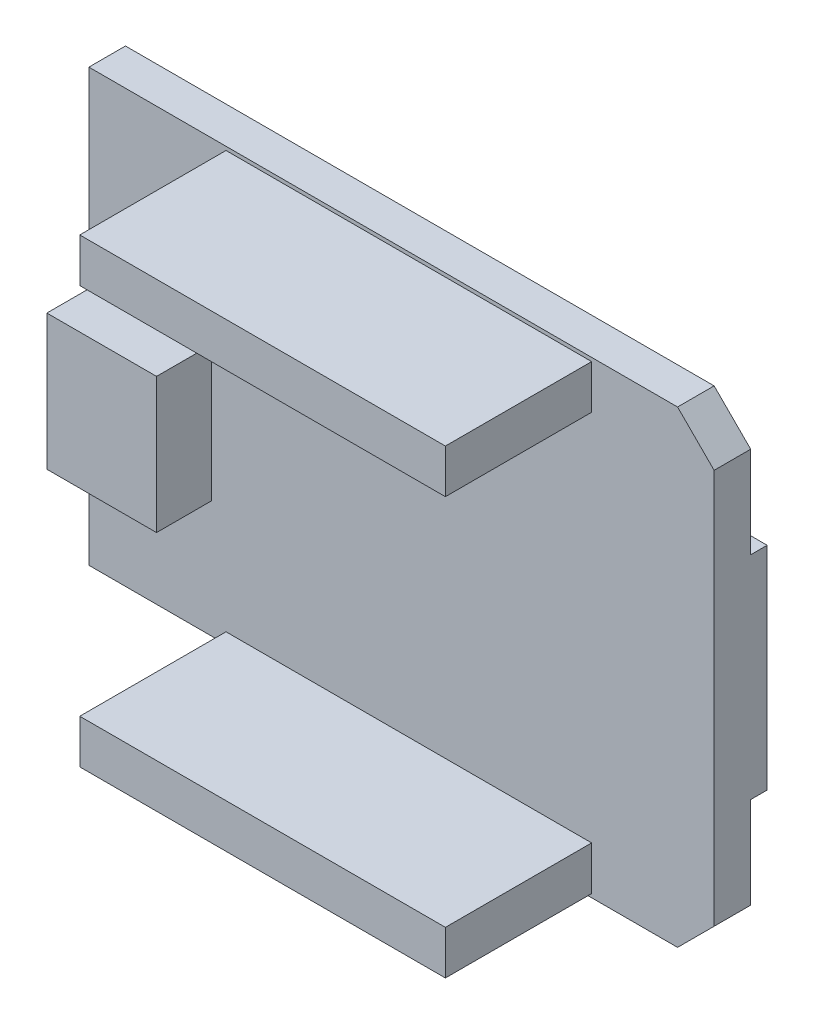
SolidWorks part; units mm, degrees
ref_plane "Plan de face" through (0, 0, 0) normal (0, 0, 1) x (1, 0, 0)
ref_plane "Plan de dessus" through (0, 0, 0) normal (0, 1, 0) x (1, 0, 0)
ref_plane "Plan de droite" through (0, 0, 0) normal (1, 0, 0) x (0, 0, -1)
sketch "Esquisse1" plane through (0, 0, 0) normal (0, 0, 1) x (1, 0, 0)
  line L0 (17.1819, 10.1033) -> (19.1819, 8.1033)
  line L1 (-15.0181, 10.1033) -> (17.1819, 10.1033)
  line L2 (-15.0181, 10.1033) -> (-15.0181, 1.1033)
  line L3 (-7.6181, -15.4967) -> (17.1819, -15.4967)
  line L4 (19.1819, 8.1033) -> (19.1819, -13.4967)
  line L5 (19.1819, -13.4967) -> (17.1819, -15.4967)
  line L6 (-15.0181, -7.8967) -> (-15.0181, -13.4967)
  line L7 (-15.0181, -13.4967) -> (-7.6181, -13.4967)
  line L10 (-7.6181, -13.4967) -> (-7.6181, -15.4967)
  line L11 (-15.0181, 1.1033) -> (-14.0181, 1.1033)
  line L13 (-15.0181, -7.8967) -> (-14.0181, -7.8967)
  line L14 (-14.0181, 1.1033) -> (-14.0181, -7.8967)
  dimension "D1" = 2
  dimension "D2" = 2
  dimension "D3" = 2
  dimension "D4" = 2
  dimension "D5" = 34.2
  dimension "D6" = 25.6
  dimension "D7" = 7.4
  dimension "D8" = 2
  dimension "D9" = 9
  dimension "D10" = 9
  dimension "D11" = 1
extrude "Boss.-Extru.1" add sketch "Esquisse1" along normal blind 2
sketch "Esquisse2" plane through (0, 0, 2) normal (0, 0, 1) x (1, 0, 0)
  line L2 (-7.5181, 9.9033) -> (-7.5181, 7.5033)
  line L3 (-7.5181, 7.5033) -> (12.4819, 7.5033)
  line L4 (12.4819, 9.9033) -> (12.4819, 7.5033)
  line L5 (-15.0181, 10.1033) -> (-15.0181, 1.1033) construction
  line L6 (-7.5181, -15.2967) -> (12.4819, -15.2967)
  line L7 (-7.5181, -15.2967) -> (-7.5181, -12.8967)
  line L8 (-7.5181, -12.8967) -> (12.4819, -12.8967)
  line L9 (12.4819, -15.2967) -> (12.4819, -12.8967)
  line L12 (-7.5181, 9.9033) -> (12.4819, 9.9033)
  line L13 (17.1819, 10.1033) -> (-15.0181, 10.1033) construction
  line L14 (-7.6181, -15.4967) -> (17.1819, -15.4967) construction
  line L15 (-15.0181, -7.8967) -> (-15.0181, -13.4967) construction
  dimension "D1" = 20
  dimension "D2" = 20
  dimension "D3" = 0.2
  dimension "D4" = 2.4
  dimension "D5" = 7.5
  dimension "D6" = 0.2
  dimension "D7" = 2.4
  dimension "D8" = 7.5
extrude "Boss.-Extru.2" add sketch "Esquisse2" along normal blind 8
sketch "Esquisse4" plane through (0, 0, 2) normal (0, 0, 1) x (1, 0, 0)
  line L1 (-14.3181, 0.3033) -> (-8.3181, 0.3033)
  line L2 (-14.3181, 0.3033) -> (-14.3181, -7.0967)
  line L3 (-14.3181, -7.0967) -> (-8.3181, -7.0967)
  line L4 (-8.3181, 0.3033) -> (-8.3181, -7.0967)
  line L5 (-15.0181, 1.1033) -> (-14.0181, 1.1033) construction
  line L6 (-14.0181, -7.8967) -> (-15.0181, -7.8967) construction
  line L7 (-15.0181, 10.1033) -> (-15.0181, 1.1033) construction
  dimension "D1" = 0.8
  dimension "D2" = 0.8
  dimension "D3" = 6
  dimension "D4" = 0.7
extrude "Boss.-Extru.3" add sketch "Esquisse4" along normal blind 3
sketch "Esquisse5" plane through (0, 0, 0) normal (0, 0, -1) x (-1, 0, 0)
  line L0 (7.6181, -15.4967) -> (-17.1819, -15.4967) construction
  line L1 (2.8181, -8.4967) -> (-12.1819, -8.4967)
  line L2 (2.8181, -8.4967) -> (2.8181, 3.1033)
  line L3 (2.8181, 3.1033) -> (-12.1819, 3.1033)
  line L4 (-12.1819, -8.4967) -> (-12.1819, 3.1033)
  line L5 (-17.1819, 10.1033) -> (15.0181, 10.1033) construction
  line L6 (-19.1819, -13.4967) -> (-19.1819, 8.1033) construction
  dimension "D1" = 7
  dimension "6" = 7
  dimension "D2" = 7
  dimension "D3" = 15
extrude "Boss.-Extru.4" add sketch "Esquisse5" along normal blind 3
sketch "Esquisse6" plane through (0, 0, 0) normal (0, 0, -1) x (-1, 0, 0)
  line L0 (-12.1819, 3.1033) -> (-12.1819, -8.4967) construction
  line L1 (-12.1819, 3.1033) -> (-19.1819, 3.1033)
  line L2 (-12.1819, 3.1033) -> (-12.1819, -8.4943)
  line L3 (-12.1819, -8.4943) -> (-19.1819, -8.4943)
  line L4 (-19.1819, 3.1033) -> (-19.1819, -8.4943)
  line L5 (-12.1819, 3.1033) -> (-12.1819, -8.4967) construction
  line L6 (-19.1819, -13.4967) -> (-19.1819, 8.1033) construction
  point P5 (-12.1819, -8.4967)
  point P10 (-19.1819, -8.4943)
extrude "Boss.-Extru.5" add sketch "Esquisse6" along normal blind 0.9
